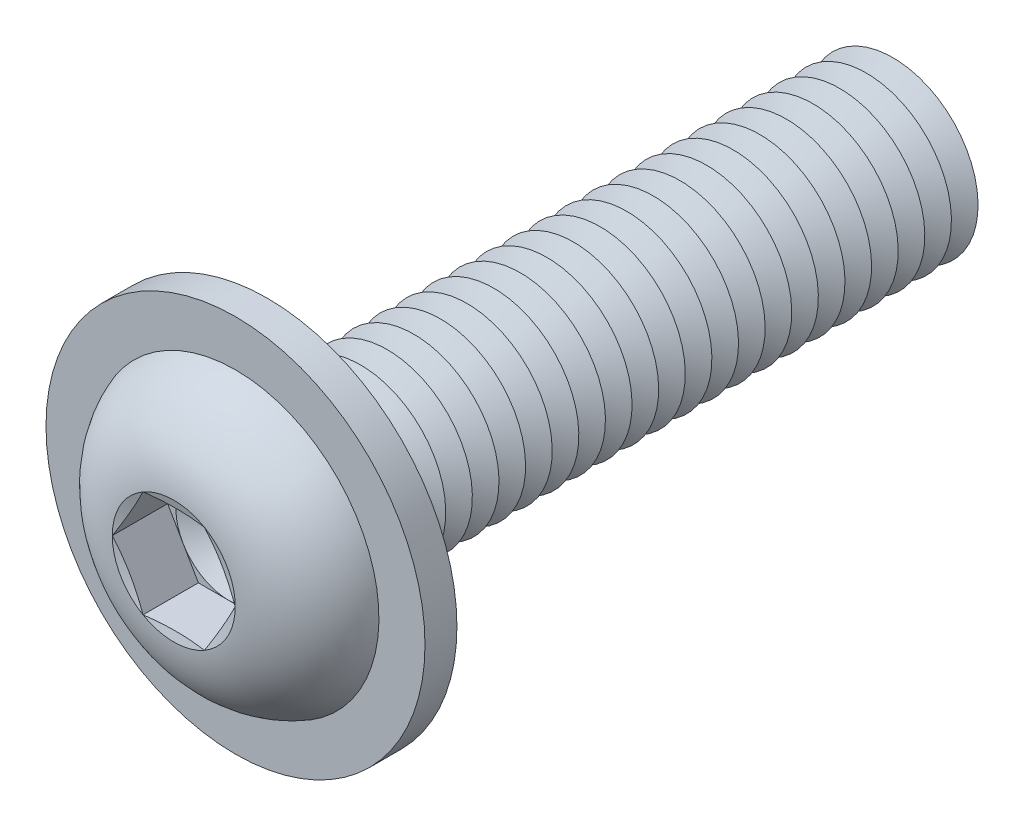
SolidWorks part; units mm, degrees
ref_plane "Front Plane" through (0, 0, 0) normal (0, 0, 1) x (1, 0, 0)
ref_plane "Top Plane" through (0, 0, 0) normal (0, 1, 0) x (1, 0, 0)
ref_plane "Right Plane" through (0, 0, 0) normal (1, 0, 0) x (0, 0, -1)
sketch "Sketch1" plane through (0, 0, 0) normal (1, 0, 0) x (0, 0, -1)
  line L0 (0, 4) -> (0, 7)
  line L3 (0, 4) -> (30, 4)
  line L4 (30, 4) -> (30, 0)
  line L5 (30, 0) -> (-4.4, 0) construction
  line L6 (-4.4, 0) -> (30, 0)
  line L7 (-4.4, 2.8867) -> (-4.4, 1.4434) construction
  line L8 (-4.4, 1.4434) -> (-4.4, 0)
  line L9 (-4.4, 2.8867) -> (-4.0132, 1.4434)
  line L10 (-4.0132, 1.4434) -> (-4.4, 1.4434)
  line L11 (30, 0) -> (22.7481, 0) construction
  line L12 (0, 7) -> (-4.4, 7) construction
  arc A1 (0, 7) -> (-4.4, 2.8867) centre (0, 2.59) ccw
  point P8 (30, 2)
  dimension "D1" = 14
  dimension "D2" = 8
  dimension "D3" = 4.4
  dimension "D4" = 5.7735
  dimension "D5" = 30
  dimension "D6" = 15
revolve "Revolve1" add sketch "Sketch1" angle 360 about L5
fillet "Fillet1" radius 0.625 1 edges at (0, 4, 0)
sketch "Sketch2" plane through (0, 0, 0) normal (1, 0, 0) x (0, 0, -1)
  line L0 (29.375, 4) -> (30.625, 4)
  line L1 (30, 4) -> (0.625, 4) construction
  line L2 (30.625, 4) -> (30, 2.9175)
  line L3 (30, -4) -> (30, 4) construction
  line L4 (30, 2.9175) -> (29.375, 4)
  dimension "D1" = 1.25
revolve "Cut-Revolve1" cut sketch "Sketch2" angle 360 about axis through (0, 0, -30) along (0, 0, -1)
pattern_linear "LPattern1" count 24 spacing 1.25 along (0, 0, 1) of "Cut-Revolve1"
sketch "Sketch3" plane through (0, 0, 4.4) normal (0, 0, 1) x (1, 0, 0)
  line L7 (1.4434, 2.5) -> (-1.4434, 2.5)
  line L8 (-1.4434, 2.5) -> (-2.8867, 0)
  line L9 (-2.8867, 0) -> (-1.4434, -2.5)
  line L10 (-1.4434, -2.5) -> (1.4434, -2.5)
  line L11 (1.4434, -2.5) -> (2.8867, 0)
  line L12 (2.8867, 0) -> (1.4434, 2.5)
  circle A0 centre (0, 0) radius 2.5 construction
  circle A3 centre (0, 0) radius 2.8867 construction
extrude "Cut-Extrude1" cut sketch "Sketch3" against normal blind 2.6
sketch "Sketch4" plane through (0, 0, 1.8) normal (0, 0, 1) x (1, 0, 0)
  line L1 (1.4434, 2.5) -> (-1.4434, 2.5) construction
  circle A0 centre (0, 0) radius 2.5
extrude "Cut-Extrude2" cut sketch "Sketch4" against normal through all draft 60
sketch "Sketch5" plane through (0, 0, 0) normal (0, 0, -1) x (-1, 0, 0)
  circle A0 centre (0, 0) radius 8.9
  circle A1 centre (0, 0) radius 4.625
  circle A2 centre (0, 0) radius 4.625 construction
  dimension "D1" = 17.8
extrude "Boss-Extrude1" add sketch "Sketch5" against normal blind 1.5
